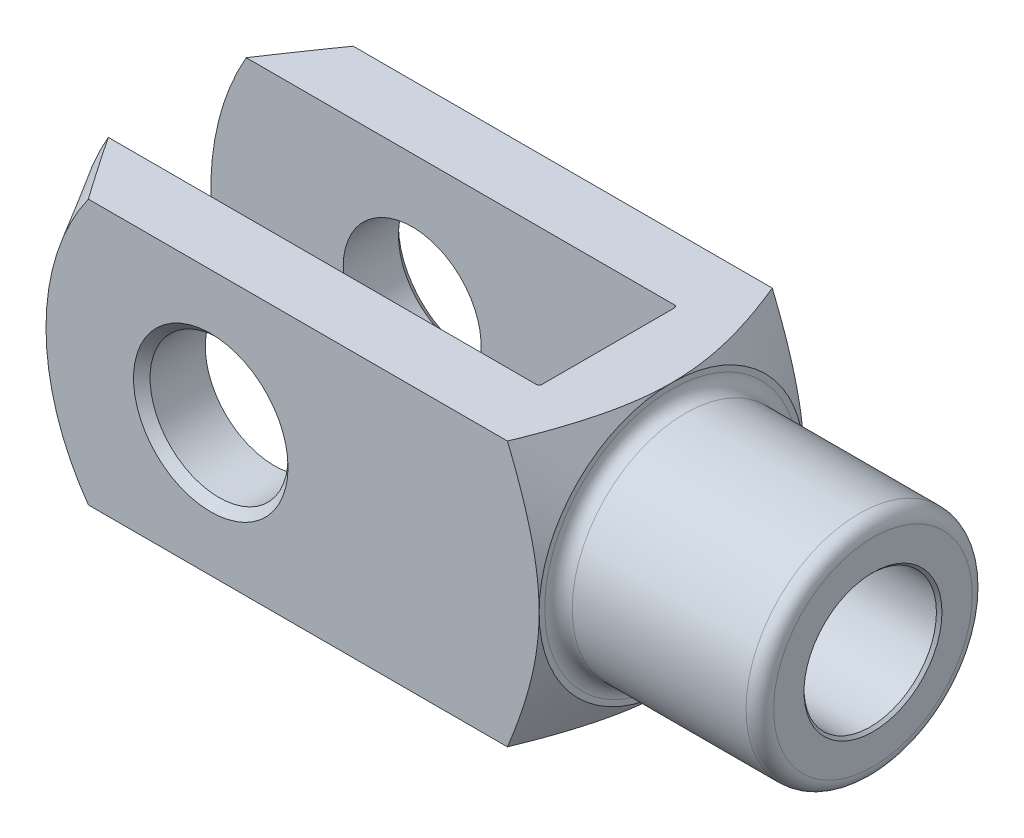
SolidWorks part; units mm, degrees
ref_plane "Front Plane" through (0, 0, 0) normal (0, 0, 1) x (1, 0, 0)
ref_plane "Top Plane" through (0, 0, 0) normal (0, 1, 0) x (1, 0, 0)
ref_plane "Right Plane" through (0, 0, 0) normal (1, 0, 0) x (0, 0, -1)
sketch "Sketch1" plane through (0, 0, 0) normal (1, 0, 0) x (0, 0, -1)
  line L0 (0, 0) -> (0, 50000) construction
  line L1 (0, 0) -> (50000, 0) construction
  line L2 (-48, -48) -> (-48, 48)
  line L3 (-48, 48) -> (48, 48)
  line L4 (48, -48) -> (48, 48)
  line L5 (-48, -48) -> (48, -48)
  point P9 (0, 48)
  point P11 (48, 0)
  point P12 (-48, 0)
  dimension "D1" = 96
  dimension "D2" = 96
extrude "Extrude1" add sketch "Sketch1" against normal blind 265
sketch "Sketch2" plane through (0, 0, 0) normal (1, 0, 0) x (0, 0, -1)
  circle A0 centre (0, 0) radius 41
  circle A1 centre (0, 0) radius 82
  dimension "D1" = 82
  dimension "D2" = 164
extrude "Extrude2" cut sketch "Sketch2" against normal blind 73
sketch "Sketch3" plane through (0, 0, 48) normal (0, 0, 1) x (1, 0, 0)
  circle A0 centre (-192, 0) radius 25
  dimension "D1" = 50
  dimension "D2" = 192
extrude "Extrude3" cut sketch "Sketch3" against normal through all
sketch "Sketch4" plane through (0, 48, 0) normal (0, 1, 0) x (1, 0, 0)
  line L0 (0, 0) -> (-50000, 0) construction
  line L1 (-265, -25) -> (-265, 25)
  line L2 (-265, 48) -> (-265, -48) construction
  line L3 (-265, 25) -> (-96, 25)
  line L4 (-96, 25) -> (-96, -25)
  line L5 (-192, 48) -> (-192, -48) construction
  line L6 (-265, -25) -> (-96, -25)
  point P7 (-192, 0)
  point P13 (-96, 0)
  point P14 (-265, 0)
  dimension "D1" = 96
  dimension "D2" = 50
extrude "Extrude4" cut sketch "Sketch4" against normal through all
fillet "Fillet1" radius 1 2 edges at (-96, 0, 25) (-96, 0, -25)
fillet "Fillet2" radius 5 2 edges at (0, 0, -41) (-73, 0, -41)
chamfer "Chamfer2" distance 3 angle 45 2 edges at (-167, 0, -48) (-167, 0, 48)
sketch "Sketch6" plane through (0, 0, 0) normal (0, 0, 1) x (1, 0, 0)
  line L0 (-73, -48) -> (-73, -96)
  line L1 (-73, -96) -> (-100.7128, -96)
  line L2 (-100.7128, -96) -> (-73, -48)
  dimension "D1" = 30
  dimension "D2" = 96
revolve "Cut-Revolve1" cut sketch "Sketch6" angle 360 about axis through (-73, 0, 0) along (1, 0, 0)
sketch "Sketch7" plane through (0, 0, 0) normal (0, 1, 0) x (1, 0, 0)
  line L0 (-251.7209, -48) -> (-265, -25)
  line L1 (-265, 25) -> (-251.7209, 48)
  line L2 (-251.7209, 48) -> (-361, 48)
  line L3 (-265, 25) -> (-265, -25)
  line L4 (-361, 48) -> (-361, -48)
  line L5 (-361, -48) -> (-251.7209, -48)
  line L6 (-265, 48) -> (-84.479, 48) construction
  line L7 (-265, -48) -> (-84.479, -48) construction
  line L8 (-169, 0.6162) -> (-169, 50000.6162) construction
  dimension "D1" = 120
  dimension "D2" = 96
  dimension "D3" = 96
revolve "Cut-Revolve2" cut sketch "Sketch7" angle 180 about L8
sketch "Sketch8" plane through (0, 0, 0) normal (1, 0, 0) x (0, 0, -1)
  circle A0 centre (0, 0) radius 24
  dimension "D1" = 48
extrude "Extrude5" cut sketch "Sketch8" against normal through all
chamfer "Chamfer3" distance 1 angle 45 1 edges at (0, 0, -24)
equation "\"D2@Sketch1\" = \"D1@Sketch1\""
equation "\"D2@Sketch2\" = \"D1@Sketch2\"*2"
equation "\"D2@Sketch6\" = \"D1@Sketch1\""
equation "\"D2@Sketch7\" = \"D1@Sketch1\""
equation "\"D3@Sketch7\" = \"D1@Sketch1\""
